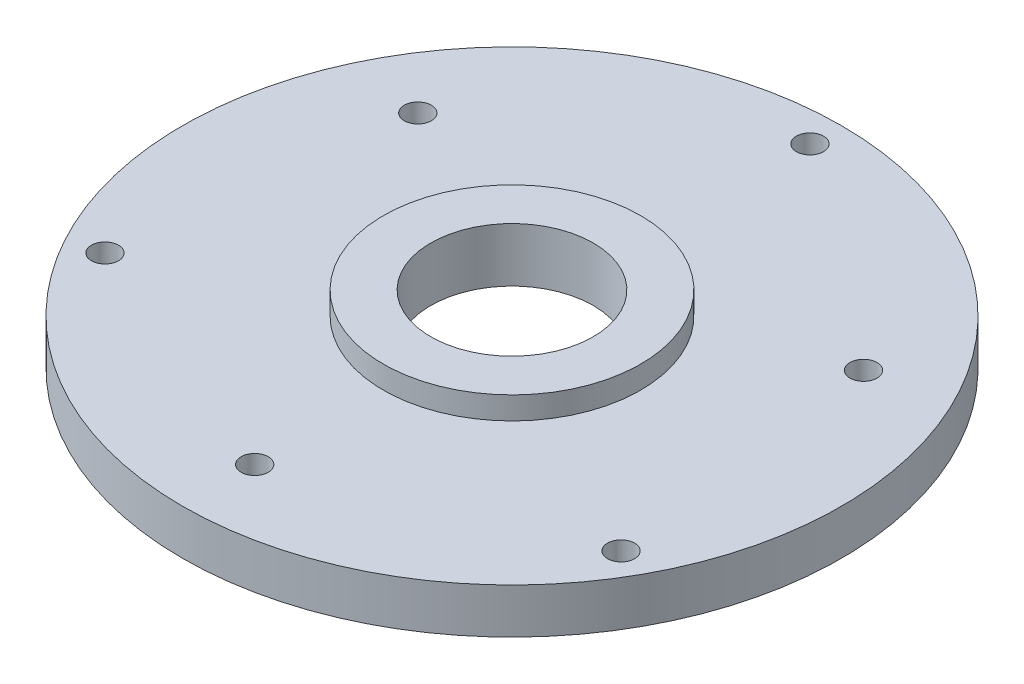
SolidWorks part; units mm, degrees
ref_plane "Piano frontale" through (0, 0, 0) normal (0, 0, 1) x (1, 0, 0)
ref_plane "Piano superiore" through (0, 0, 0) normal (0, 1, 0) x (1, 0, 0)
ref_plane "Piano destro" through (0, 0, 0) normal (1, 0, 0) x (0, 0, -1)
sketch "Schizzo1" plane through (0, 0, 0) normal (0, 0, 1) x (1, 0, 0)
  line L0 (0, 0) -> (0, 68.8521) construction
  line L4 (36.5, 39.3859) -> (36.5, 34.3859)
  line L10 (15, 34.3859) -> (36.5, 34.3859)
  line L11 (15, 34.3859) -> (15, 35.8859)
  line L12 (15, 35.8859) -> (9, 35.8859)
  line L15 (9, 41.8859) -> (14.25, 41.8859)
  line L16 (14.25, 41.8859) -> (14.25, 39.3859)
  line L17 (9, 35.8859) -> (9, 41.8859)
  line L18 (14.25, 39.3859) -> (36.5, 39.3859)
  dimension "D1" = 14.25
  dimension "D2" = 36.5
  dimension "D3" = 1.5
  dimension "D4" = 2.5
  dimension "D5" = 9
  dimension "D6" = 5
  dimension "D7" = 15
revolve "Rivoluzione1" add sketch "Schizzo1" angle 360 about L0
sketch "Schizzo2" plane through (0, 39.3859, 0) normal (0, 1, 0) x (1, 0, 0)
  circle A0 centre (0, 33) radius 1.5
  circle A1 centre (28.5788, -16.5) radius 1.5
  circle A2 centre (-28.5788, -16.5) radius 1.5
  point P10 (0, 0)
  dimension "D1" = 3
  dimension "D2" = 33
  dimension "D3" = 3
extrude "Taglio-Estrusione1" cut sketch "Schizzo2" against normal through all
sketch "Schizzo6" plane through (0, 34.3859, 0) normal (0, -1, 0) x (-1, 0, 0)
  circle A0 centre (0, -28.5) radius 1.5
  circle A1 centre (-24.6817, 14.25) radius 1.5
  circle A2 centre (24.6817, 14.25) radius 1.5
  point P10 (0, 0)
  dimension "D1" = 28.5
  dimension "D3" = 3
  dimension "D2" = 3
extrude "Taglio-Estrusione3" cut sketch "Schizzo6" against normal through all contours A1
